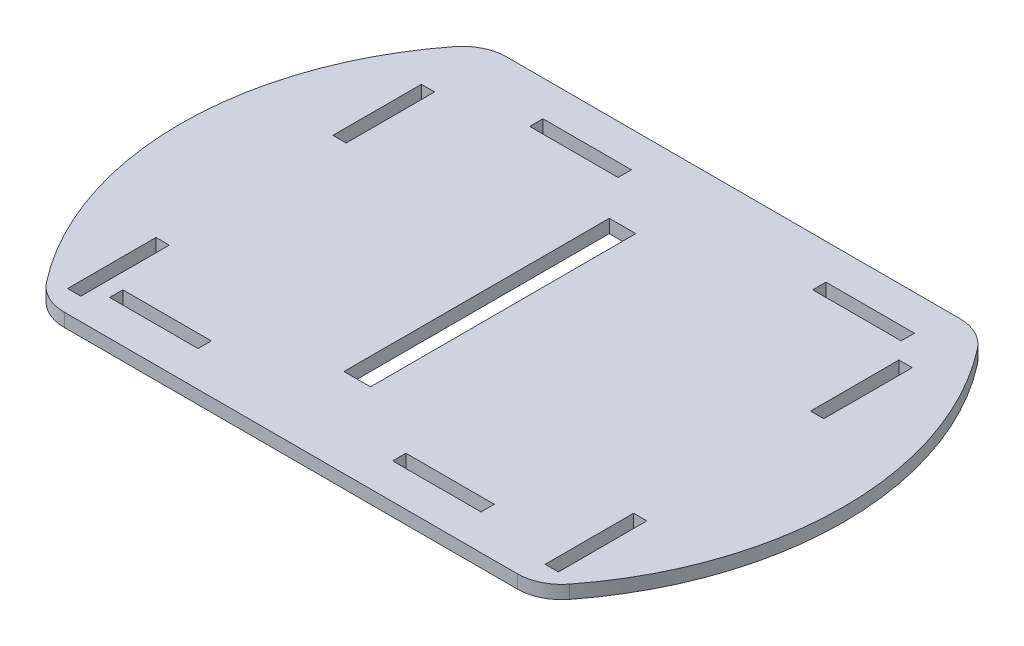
SolidWorks part; units mm, degrees
ref_plane "Front Plane" through (0, 0, 0) normal (0, 0, 1) x (1, 0, 0)
ref_plane "Top Plane" through (0, 0, 0) normal (0, 1, 0) x (1, 0, 0)
ref_plane "Right Plane" through (0, 0, 0) normal (1, 0, 0) x (0, 0, -1)
sketch "Sketch1" plane through (0, 0, 0) normal (0, 1, 0) x (1, 0, 0)
  line L0 (-52.0481, 54) -> (52.0481, 54)
  line L1 (-52.0481, -54) -> (52.0481, -54)
  line L2 (-55, 0) -> (55, 0) construction
  arc A0 (-52.0481, 54) -> (-74.1889, 11) centre (0, 0) ccw
  arc A1 (52.0481, -54) -> (74.1889, -11) centre (0, 0) ccw
  arc A2 (74.1889, 11) -> (52.0481, 54) centre (0, 0) ccw
  arc A3 (-74.1889, -11) -> (-52.0481, -54) centre (0, 0) ccw
  arc A4 (-74.1889, 11) -> (-74.1889, -11) centre (0, 0) ccw
  arc A5 (74.1889, 11) -> (74.1889, -11) centre (0, 0) cw
  point P5 (0, 54)
  dimension "D1" = 150
  dimension "D2" = 54
  dimension "D3" = 54
extrude "Boss-Extrude1" add sketch "Sketch1" along normal blind 3
sketch "Sketch2" plane through (0, 3, 0) normal (0, 1, 0) x (1, 0, 0)
  line L1 (52.5, 35) -> (55.5, 35)
  line L2 (52.5, 35) -> (52.5, 15)
  line L3 (52.5, 15) -> (55.5, 15)
  line L4 (55.5, 35) -> (55.5, 15)
  line L5 (52.5, -25) -> (55.5, -25)
  line L6 (52.5, -25) -> (52.5, -45)
  line L7 (52.5, -45) -> (55.5, -45)
  line L8 (55.5, -25) -> (55.5, -45)
  line L9 (-52.0481, -54) -> (52.0481, -54) construction
  line L10 (0, -1.65) -> (0, 1.65) construction
  line L11 (-55.5, -25) -> (-55.5, -45)
  line L12 (-52.5, -45) -> (-55.5, -45)
  line L13 (-52.5, -25) -> (-52.5, -45)
  line L14 (-52.5, -25) -> (-55.5, -25)
  line L15 (-55.5, 35) -> (-55.5, 15)
  line L16 (-52.5, 15) -> (-55.5, 15)
  line L17 (-52.5, 35) -> (-52.5, 15)
  line L18 (-52.5, 35) -> (-55.5, 35)
  dimension "D1" = 20
  dimension "D2" = 3
  dimension "D3" = 3
  dimension "D4" = 20
  dimension "D5" = 52.5
  dimension "D6" = 52.5
  dimension "D7" = 9
  dimension "D8" = 40
extrude "Cut-Extrude1" cut sketch "Sketch2" against normal blind 10
sketch "Sketch3" plane through (0, 3, 0) normal (0, 1, 0) x (1, 0, 0)
  line L0 (0, -1.65) -> (0, 1.65) construction
  line L1 (-49, -39) -> (-29, -39)
  line L2 (-49, -39) -> (-49, -42)
  line L3 (-49, -42) -> (-29, -42)
  line L4 (-29, -39) -> (-29, -42)
  line L5 (15, -39) -> (35, -39)
  line L6 (15, -39) -> (15, -42)
  line L7 (15, -42) -> (35, -42)
  line L8 (35, -39) -> (35, -42)
  line L9 (-52.0481, -54) -> (52.0481, -54) construction
  line L10 (52.0481, 54) -> (-52.0481, 54) construction
  line L11 (-35, 42) -> (-15, 42)
  line L12 (-35, 42) -> (-35, 39)
  line L13 (-35, 39) -> (-15, 39)
  line L14 (-15, 42) -> (-15, 39)
  line L15 (29, 42) -> (49, 42)
  line L16 (29, 42) -> (29, 39)
  line L17 (29, 39) -> (49, 39)
  line L18 (49, 42) -> (49, 39)
  point P10 (-29, -40.5)
  dimension "D1" = 20
  dimension "D2" = 3
  dimension "D3" = 3
  dimension "D4" = 20
  dimension "D5" = 29
  dimension "D6" = 15
  dimension "D7" = 12
  dimension "D8" = 12
  dimension "D9" = 20
  dimension "D10" = 3
  dimension "D11" = 3
  dimension "D12" = 20
  dimension "D13" = 12
  dimension "D14" = 12
  dimension "D15" = 15
  dimension "D16" = 29
extrude "Cut-Extrude2" cut sketch "Sketch3" against normal blind 3
sketch "Sketch4" plane through (0, 3, 0) normal (0, 1, 0) x (1, 0, 0)
  line L0 (-52.0481, -54) -> (52.0481, -54) construction
  line L1 (-59.7699, -56) -> (60.2713, -56)
  line L2 (-59.7699, -56) -> (-59.7699, -50)
  line L3 (-59.7699, -50) -> (60.2713, -50)
  line L4 (60.2713, -56) -> (60.2713, -50)
  line L5 (-1.65, 0) -> (1.65, 0) construction
  line L6 (60.2713, 56) -> (60.2713, 50)
  line L7 (-59.7699, 50) -> (60.2713, 50)
  line L8 (-59.7699, 56) -> (-59.7699, 50)
  line L9 (-59.7699, 56) -> (60.2713, 56)
  dimension "D1" = 4
  dimension "D2" = 6
extrude "Cut-Extrude3" cut sketch "Sketch4" against normal blind 3
sketch "Sketch6" plane through (0, 3, 0) normal (0, 1, 0) x (1, 0, 0)
  line L0 (-1.65, 0) -> (1.65, 0) construction
  line L1 (-2, 30) -> (-8, 30)
  line L2 (-2, 30) -> (-2, -30)
  line L3 (-2, -30) -> (-8, -30)
  line L4 (-8, 30) -> (-8, -30)
  line L5 (0, -1.65) -> (0, 1.65) construction
  point P0 (0, 0)
  dimension "D1" = 60
  dimension "D2" = 6
  dimension "D3" = 30
  dimension "D4" = 2
extrude "Cut-Extrude5" cut sketch "Sketch6" against normal blind 3
fillet "Fillet1" radius 10 4 edges at (-55.9017, 1.5, -50) (55.9017, 1.5, -50) (55.9017, 1.5, 50) (-55.9017, 1.5, 50)
sketch "Sketch7" plane through (0, 3, 0) normal (0, 1, 0) x (1, 0, 0)
  line L0 (52.5, 35) -> (52.5, 15) construction
  line L1 (-2.5, 33) -> (50.5, 33)
  line L2 (-2.5, 33) -> (-2.5, 30)
  line L3 (-2.5, -33) -> (50.5, -33)
  line L4 (50.5, 33) -> (50.5, -33)
  line L5 (29, 39) -> (49, 39) construction
  line L7 (-50.5, 21.5) -> (-8, 21.5)
  line L8 (-50.5, 21.5) -> (-50.5, -21.5)
  line L9 (-50.5, -21.5) -> (-8, -21.5)
  line L11 (-8, 30) -> (-8, -30) construction
  line L12 (-52.5, 15) -> (-52.5, 35) construction
  line L13 (-35, 39) -> (-15, 39) construction
  line L15 (-2, 30) -> (-8, 30) construction
  line L18 (-8, -30) -> (-2, -30) construction
  line L19 (-2.5, -30) -> (-2.5, -33)
  dimension "D1" = 53
  dimension "D2" = 66
  dimension "D3" = 2
  dimension "D4" = 6
  dimension "D5" = 43
  dimension "D7" = 2
  dimension "D8" = 17.5
